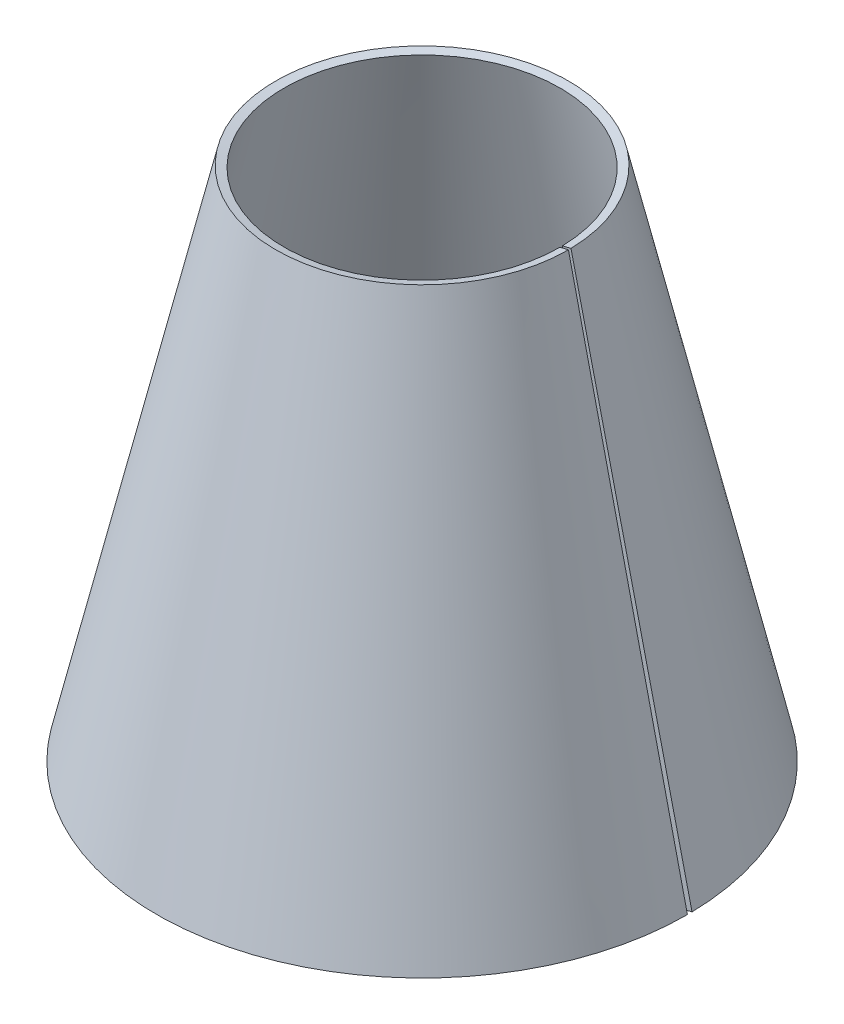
SolidWorks part; units mm, degrees
ref_plane "Front" through (0, 0, 0) normal (0, 0, 1) x (1, 0, 0)
ref_plane "Top" through (0, 0, 0) normal (0, 1, 0) x (1, 0, 0)
ref_plane "Right" through (0, 0, 0) normal (1, 0, 0) x (0, 0, -1)
sketch "Sketch1" plane through (0, 0, 0) normal (0, 0, 1) x (1, 0, 0)
  line L0 (17.0183, 60.0317) -> (30.8574, 0)
  line L1 (0, 64.1461) -> (0, -15.8963) construction
revolve "Revolve-Thin1" add sketch "Sketch1" angle 359 about L1
sheet metal parameters "Sheet-Metal1" thickness 1 parameters "D1"=2
bend "RoundBend1" bend radius 16.0439 bend angle 359 parameters "D5"=1
flatten bends "Flatten-Bends1" thickness 1 parameters "D1"=0
sketch "Sharp-Sketch1" plane through (23.9379, 30.0159, 0) normal (0.9744, 0.2246, 0) x (0, 0, -1)
  line L0 (-88.8876, 1.8329) -> (-49.0228, 48.8024) construction
process bends "Process-Bends1" thickness 1 parameters "D1"=0
sketch "Flat-Sketch1" plane through (29.3003, 6.7546, 0) normal (0.9744, 0.2246, 0) x (0, 0, -1)
